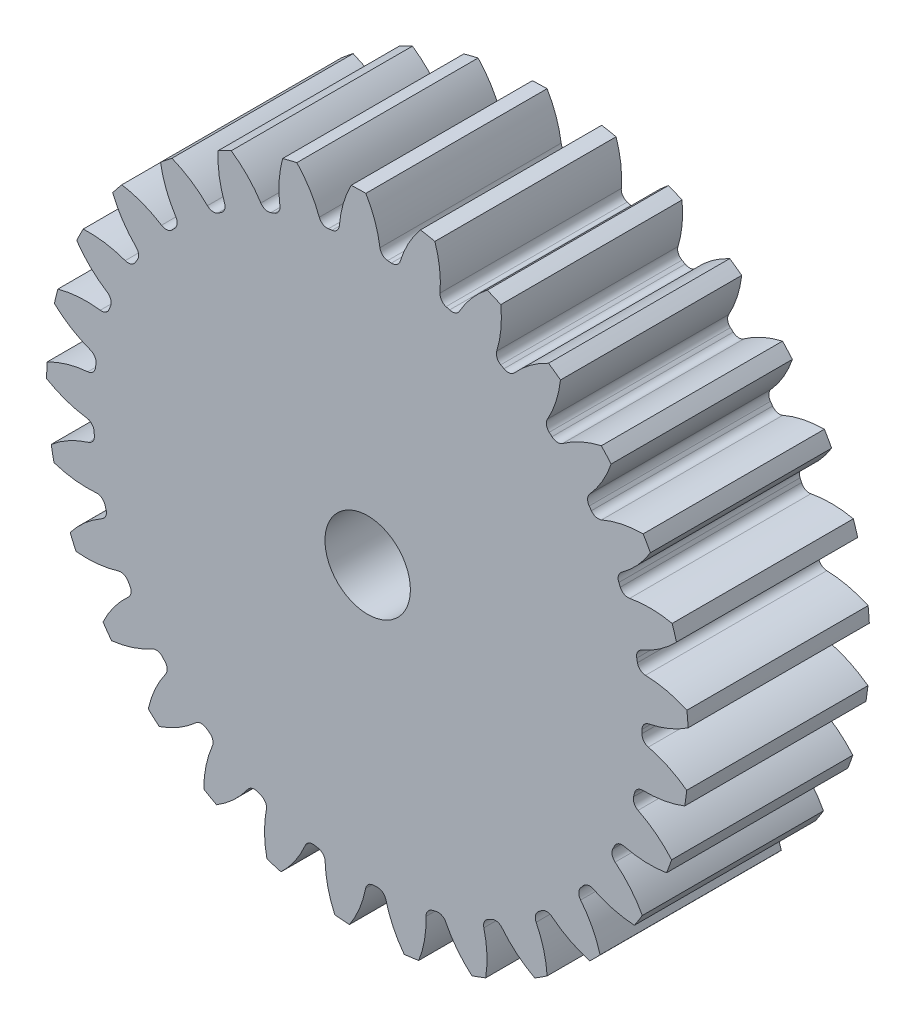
SolidWorks part; units mm, degrees
ref_plane "Front" through (0, 0, 0) normal (0, 0, 1) x (1, 0, 0)
ref_plane "Top" through (0, 0, 0) normal (0, 1, 0) x (1, 0, 0)
ref_plane "Right" through (0, 0, 0) normal (1, 0, 0) x (0, 0, -1)
sketch "Sketch3" plane through (0, 0, 0) normal (0, 0, 1) x (1, 0, 0)
  circle A0 centre (0, 0) radius 157.48
  dimension "od" = 314.96
extrude "gearBody" add sketch "Sketch3" along normal blind 88.9
sketch "Sketch2" plane through (0, 0, 0) normal (0, 0, 1) x (1, 0, 0)
  line L0 (0, 0) -> (127.8977, 52.977) construction
  line L1 (156.783, -17.6494) -> (0, 0) construction
  line L2 (0, 0) -> (36.3143, 0) construction
  line L3 (147.2605, 4.1874) -> (146.8542, -11.7063) construction
  line L5 (147.0573, -3.7594) -> (0, 0) construction
  line L7 (0, 0) -> (138.4355, 0) construction
  arc A0 (138.4268, 1.5525) -> (138.1667, -8.6235) centre (0, 0) ccw construction
  arc A1 (157.1978, 9.4242) -> (156.5109, -17.444) centre (0, 0) ccw construction
  arc A2 (147.2605, 4.1874) -> (146.8542, -11.7063) centre (0, 0) ccw construction
  arc A3 (134.5496, -4.3546) -> (134.5963, -2.526) centre (0, 0) ccw
  arc A4 (156.783, -17.6494) -> (137.6851, -8.5014) centre (125.0238, -59.4428) ccw
  arc A5 (156.783, -17.6494) -> (157.48, 9.6154) centre (0, 0) ccw
  arc A6 (157.48, 9.6154) -> (137.9396, 1.4552) centre (127.8977, 52.977) cw
  arc A7 (134.5963, -2.526) -> (137.9396, 1.4552) centre (138.7307, -2.6036) cw
  arc A8 (137.6851, -8.5014) -> (134.5496, -4.3546) centre (138.6825, -4.4883) cw
  point P6 (157.48, 9.6154)
  point P22 (156.783, -17.6494)
  dimension "baseDia" = 276.871
  dimension "od" = 314.96
  dimension "pd" = 294.64
  dimension "rd" = 269.24
  dimension "rFillet" = 4.1351
  dimension "pointX" = 157.48
  dimension "pointY" = 9.6154
  dimension "CTT" = 15.8937
  dimension "flankCenterAngle" = 22.5
extrude "toothCut" cut sketch "Sketch2" along normal through all
pattern_circular "CirPattern1" count 29 over 360 about axis through (0, 0, 0) along (0, 0, 1) of "toothCut"
sketch "hub1Dia" plane through (0, 0, 0) normal (0, 0, -1) x (-1, 0, 0)
  circle A0 centre (0, 0) radius 12.7
  dimension "hub1Dia" = 25.4
sketch "hub2Dia" plane through (0, 0, 88.9) normal (0, 0, 1) x (1, 0, 0)
  circle A0 centre (0, 0) radius 12.7
  dimension "hub2dia" = 25.4
sketch "boreDia" plane through (0, 0, 0) normal (0, 0, 1) x (1, 0, 0)
  circle A0 centre (0, 0) radius 20.955
  dimension "boreDia" = 41.91
extrude "bore" cut sketch "boreDia" against normal mid plane 25400
